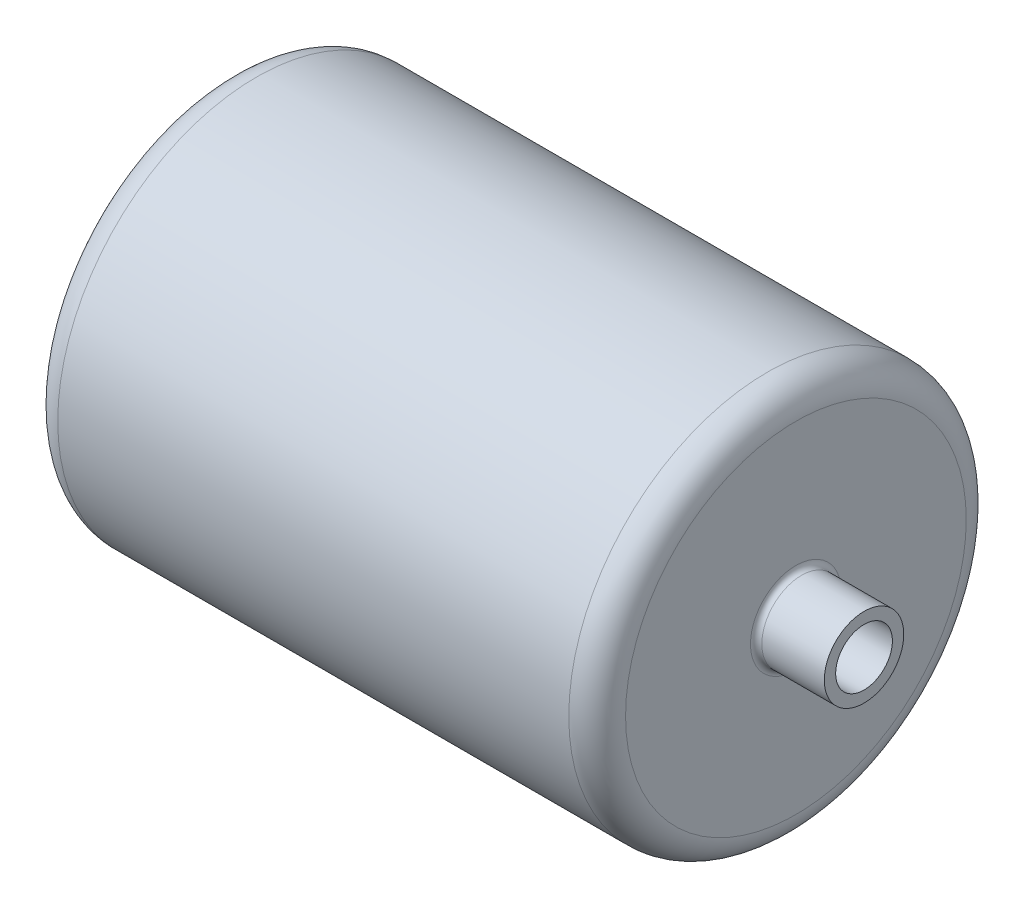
SolidWorks part; units mm, degrees
ref_plane "Front Plane" through (0, 0, 0) normal (0, 0, 1) x (1, 0, 0)
ref_plane "Top Plane" through (0, 0, 0) normal (0, 1, 0) x (1, 0, 0)
ref_plane "Right Plane" through (0, 0, 0) normal (1, 0, 0) x (0, 0, -1)
sketch "Sketch1" plane through (0, 0, 0) normal (0, 0, 1) x (1, 0, 0)
  line L0 (-225, 175) -> (225, 175)
  line L1 (-250, 150) -> (-250, 0)
  line L2 (-225, 0) -> (-225, 137.5)
  line L3 (-212.5, 150) -> (212.5, 150)
  line L4 (225, 137.5) -> (225, 25)
  line L5 (225, 25) -> (310, 25)
  line L6 (310, 25) -> (310, 35)
  line L7 (310, 35) -> (250, 35)
  line L8 (250, 35) -> (250, 150)
  line L9 (-225, 0) -> (-250, 0)
  line L10 (-162.2867, 0) -> (219.9588, 0) construction
  arc A0 (-225, 137.5) -> (-212.5, 150) centre (-212.5, 137.5) cw
  arc A1 (225, 137.5) -> (212.5, 150) centre (212.5, 137.5) ccw
  arc A2 (250, 150) -> (225, 175) centre (225, 150) ccw
  arc A3 (-250, 150) -> (-225, 175) centre (-225, 150) cw
  point P19 (250, 175)
  point P22 (-250, 175)
  dimension "D11" = 12.5
  dimension "D12" = 12.5
  dimension "D13" = 25
  dimension "D14" = 150
  dimension "D2" = 25
  dimension "D3" = 25
  dimension "D4" = 500
  dimension "D5" = 35
  dimension "D6" = 25
  dimension "D7" = 85
  dimension "D8" = 250
  dimension "D9" = 150
  dimension "D10" = 175
revolve "Revolve1" add sketch "Sketch1" angle 360 about L10
sketch "Sketch4" plane through (0, 0, 0) normal (1, 0, 0) x (0, 0, -1)
  line L0 (0, 190.4729) -> (0, -189.774)
extrude "Half-Model of Cylinder" cut sketch "Sketch4" against normal through all and the other way through all flip side to cut
fillet "Pipe Connector Fillet" radius 5 1 edges at (250, 0, 35)
